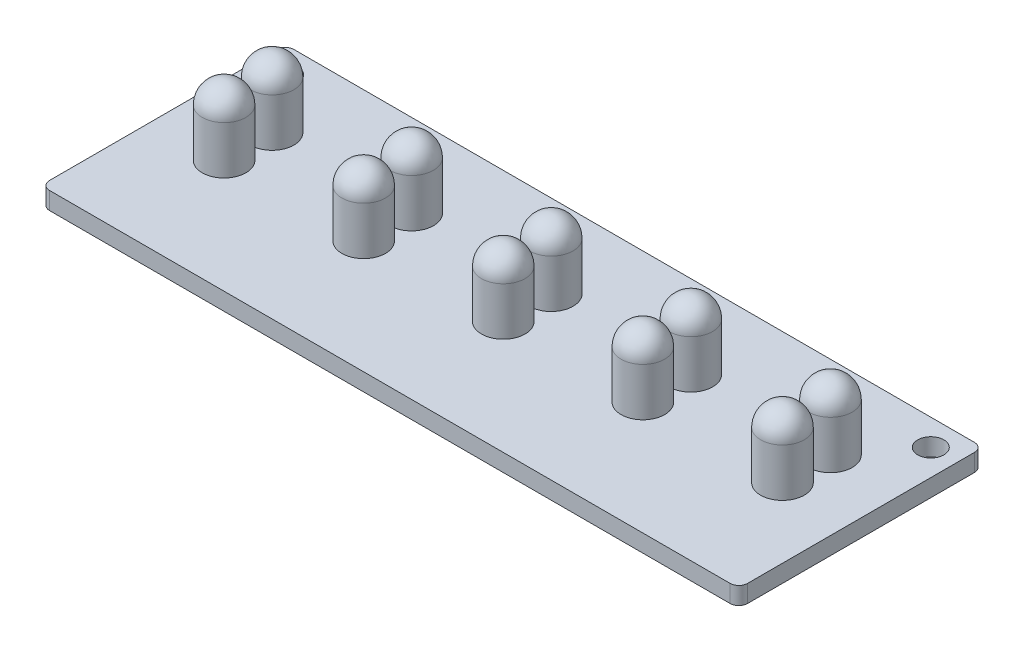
SolidWorks part; units mm, degrees
ref_plane "Front Plane" through (0, 0, 0) normal (0, 0, 1) x (1, 0, 0)
ref_plane "Top Plane" through (0, 0, 0) normal (0, 1, 0) x (1, 0, 0)
ref_plane "Right Plane" through (0, 0, 0) normal (1, 0, 0) x (0, 0, -1)
sketch "Sketch1" plane through (0, 0, 0) normal (0, 1, 0) x (1, 0, 0)
  line L1 (-40, -14) -> (40, -14)
  line L2 (-40, -14) -> (-40, 14)
  line L3 (-40, 14) -> (40, 14)
  line L4 (40, -14) -> (40, 14)
  line L5 (-40, -14) -> (40, 14) construction
  line L6 (-40, 14) -> (40, -14) construction
  point P0 (0, 0)
  dimension "D1" = 28
  dimension "D2" = 80
extrude "Boss-Extrude1" add sketch "Sketch1" along normal blind 2
sketch "Sketch2" plane through (0, 2, 0) normal (0, 1, 0) x (1, 0, 0)
  line L0 (0, 0) -> (0, 50000) construction
  line L1 (-37, 17.2778) -> (-37, -15.4591) construction
  line L2 (-40, 14) -> (-40, -14) construction
  line L4 (40, 14) -> (-40, 14) construction
  circle A0 centre (-37, 11) radius 1.5
  circle A1 centre (37, 11) radius 1.5
  dimension "D2" = 3
  dimension "D1" = 3
  dimension "D3" = 3
extrude "Cut-Extrude1" cut sketch "Sketch2" against normal blind 2
sketch "Sketch3" plane through (0, 0, 0) normal (0, 1, 0) x (1, 0, 0)
  line L0 (40, 14) -> (-40, 14) construction
  line L1 (-15, 12.5) -> (5, 12.5)
  line L2 (-15, 12.5) -> (-15, 7.5)
  line L3 (-15, 7.5) -> (5, 7.5)
  line L4 (5, 12.5) -> (5, 7.5)
  line L5 (-15, 12.5) -> (5, 7.5) construction
  line L6 (-15, 7.5) -> (5, 12.5) construction
  point P0 (-5, 10)
  dimension "D1" = 5
  dimension "D2" = 1.5
  dimension "20" = 20
  dimension "D3" = 5
extrude "Boss-Extrude2" add sketch "Sketch3" against normal blind 6
sketch "Sketch4" plane through (0, 0, 0) normal (1, 0, 0) x (0, 0, -1)
  line L0 (-1, 11.8614) -> (-1, -4.9117) construction
  line L1 (14, 2) -> (14, 0) construction
  line L2 (-3.5, 2) -> (-3.5, 7.5)
  line L3 (-14, 2) -> (14, 2) construction
  line L4 (-1, 10) -> (-1, 2)
  line L5 (-1, 2) -> (-3.5, 2)
  arc A1 (-3.5, 7.5) -> (-1, 10) centre (-1, 7.5) cw
  point P9 (-3.5, 7.5483)
  point P12 (-1, 11.1714)
  point P13 (-1, 9.8982)
  dimension "D4" = 2.5
  dimension "D1" = 15
  dimension "D2" = 8
  dimension "D3" = 2.5
revolve "Revolve1" add sketch "Sketch4" angle 360 about L0
pattern_linear "LPattern2" count 2 spacing 5.5 along (0, 0, -1) of "Revolve1"
pattern_linear "LPattern3" count 3 spacing 16 along (1, 0, 0) count 3 spacing 16 along (-1, 0, 0) of "Revolve1", "LPattern2"
fillet "Fillet1" radius 1 4 edges at (40, 1, -14) (-40, 1, -14) (-40, 1, 14) (40, 1, 14)
